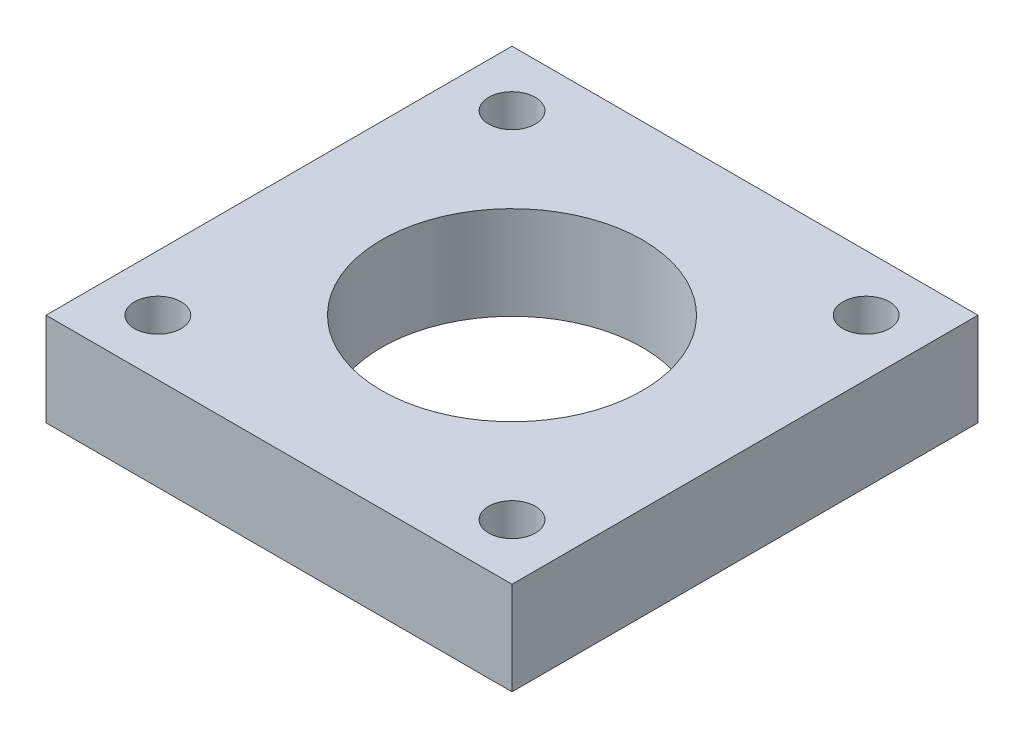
SolidWorks part; units mm, degrees
ref_plane "Спереди" through (0, 0, 0) normal (0, 0, 1) x (1, 0, 0)
ref_plane "Сверху" through (0, 0, 0) normal (0, 1, 0) x (1, 0, 0)
ref_plane "Справа" through (0, 0, 0) normal (1, 0, 0) x (0, 0, -1)
sketch "Эскиз1" plane through (0, 0, 0) normal (0, 1, 0) x (1, 0, 0)
  line L1 (25, 25) -> (-25, 25)
  line L2 (25, 25) -> (25, -25)
  line L3 (25, -25) -> (-25, -25)
  line L4 (-25, 25) -> (-25, -25)
  line L5 (25, 25) -> (-25, -25) construction
  line L6 (25, -25) -> (-25, 25) construction
  point P0 (0, 0)
  dimension "D1" = 50
  dimension "D2" = 50
extrude "Бобышка-Вытянуть1" add sketch "Эскиз1" along normal blind 10
hole_wizard "Отверстие обработанное метчиком M61" positions "Эскиз2" profile "Эскиз3" tap size "M6" standard "ISO"
sketch "Эскиз2" plane through (0, 10, 0) normal (0, 1, 0) x (1, 0, 0)
  point P0 (-19, 19)
  point P2 (19, 19)
  point P4 (19, -19)
  point P6 (-19, -19)
  dimension "D1" = 38
  dimension "D2" = 19
  dimension "D3" = 19
  dimension "D4" = 38
sketch "Эскиз3" plane through (-19, 10, -19) normal (1, 0, 0) x (0, 0, 1)
  line L0 (0, 0) -> (0, 11.5022)
  line L1 (0, 11.5022) -> (2.5, 10)
  line L2 (2.5, 10) -> (2.5, 0)
  line L5 (2.5, 0) -> (0, 0)
  line L10 (0, 11.5022) -> (-2.5, 10) construction
  line L11 (0, -6.35) -> (0, 107.95) construction
  dimension "Диаметр сверла" = 5
  dimension "Глубина сверла" = 10
  dimension "Угол заточки сверла" = 118
hole_wizard "Отверстие обработанное метчиком M30x2.01" positions "Эскиз4" profile "Эскиз5" tap size "M30x2.0" standard "ISO"
sketch "Эскиз4" plane through (0, 10, 0) normal (0, 1, 0) x (1, 0, 0)
  point P0 (0, 0)
sketch "Эскиз5" plane through (0, 10, 0) normal (1, 0, 0) x (0, 0, 1)
  line L0 (0, 0) -> (0, 18.412)
  line L1 (0, 18.412) -> (14, 10)
  line L2 (14, 10) -> (14, 0)
  line L5 (14, 0) -> (0, 0)
  line L10 (0, 18.412) -> (-14, 10) construction
  line L11 (0, -6.35) -> (0, 107.95) construction
  dimension "Диаметр сверла" = 28
  dimension "Глубина сверла" = 10
  dimension "Угол заточки сверла" = 118
